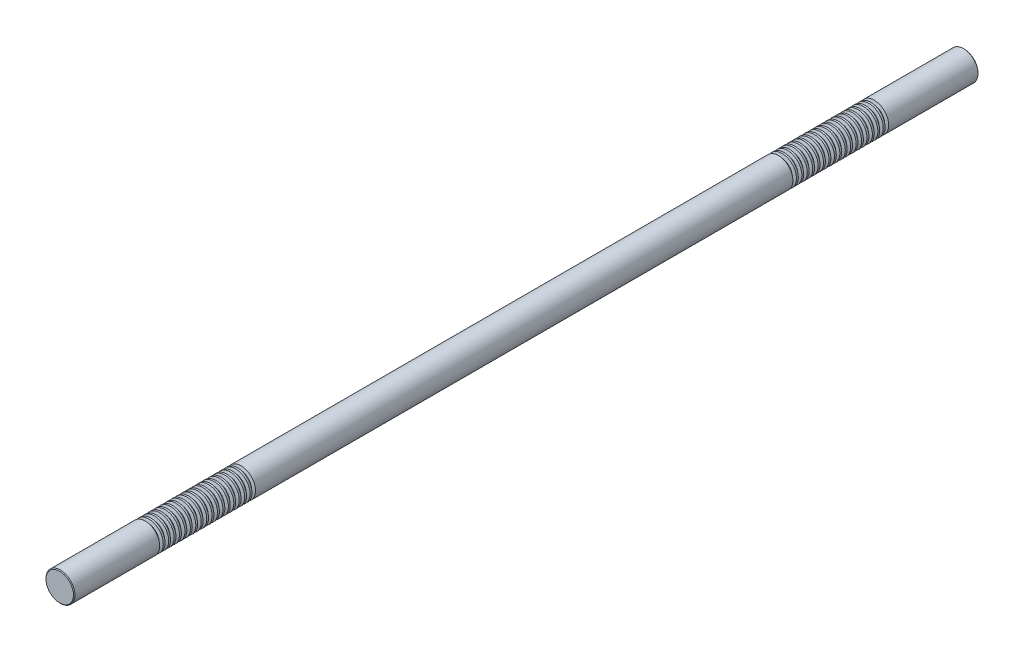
SolidWorks part; units mm, degrees
ref_plane "Front Plane" through (0, 0, 0) normal (0, 0, 1) x (1, 0, 0)
ref_plane "Top Plane" through (0, 0, 0) normal (0, 1, 0) x (1, 0, 0)
ref_plane "Right Plane" through (0, 0, 0) normal (1, 0, 0) x (0, 0, -1)
sketch "Sketch1" plane through (0, 0, 0) normal (0, 0, 1) x (1, 0, 0)
  circle A0 centre (0, 0) radius 16
  dimension "D1" = 32
extrude "Boss-Extrude1" add sketch "Sketch1" along normal mid plane 1000
chamfer "Chamfer1" distance 0.8 angle 45 2 edges at (16, 0, -500) (16, 0, 500)
sketch "Sketch2" plane through (0, 0, 0) normal (1, 0, 0) x (0, 0, -1)
  line L0 (400.4689, 16) -> (396.5311, 16)
  line L1 (499.2, 16) -> (-499.2, 16) construction
  line L2 (396.5311, 16) -> (397.4689, 12.5)
  line L3 (397.4689, 12.5) -> (399.5311, 12.5)
  line L4 (399.5311, 12.5) -> (400.4689, 16)
  line L5 (500, -15.2) -> (500, 15.2) construction
  point P4 (398.5, 16)
  point P7 (398.5, 12.5)
  point P8 (400, 14.25)
  point P9 (397, 14.25)
  dimension "D1" = 3
  dimension "D2" = 100
  dimension "D3" = 3.5
  dimension "D4" = 30
revolve "Cut-Revolve1" cut sketch "Sketch2" angle 360 about axis through (0, 0, 500) along (0, 0, -1)
pattern_linear "LPattern1" count 18 spacing 6 along (0, 0, 1) of "Cut-Revolve1"
pattern_linear "LPattern2" count 2 spacing 700 along (0, 0, 1) of "Cut-Revolve1", "LPattern1"
